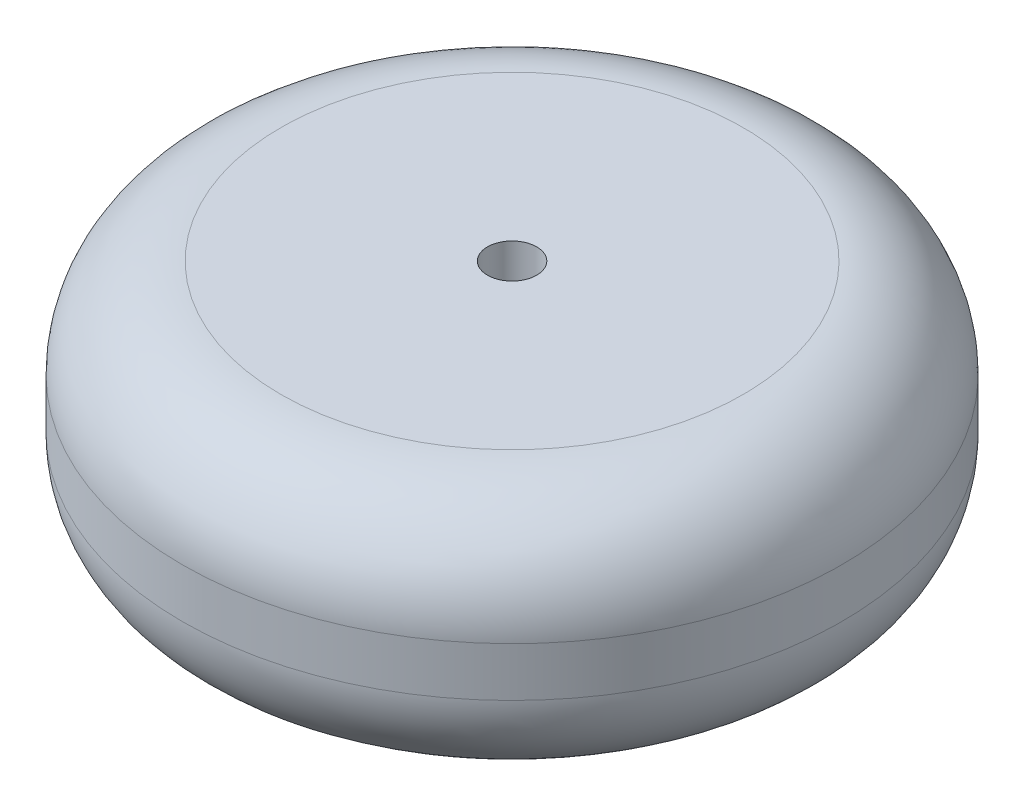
SolidWorks part; units mm, degrees
ref_plane "Front Plane" through (0, 0, 0) normal (0, 0, 1) x (1, 0, 0)
ref_plane "Top Plane" through (0, 0, 0) normal (0, 1, 0) x (1, 0, 0)
ref_plane "Right Plane" through (0, 0, 0) normal (1, 0, 0) x (0, 0, -1)
sketch "Sketch1" plane through (0, 0, 0) normal (0, 1, 0) x (1, 0, 0)
  circle A0 centre (0, 0) radius 33.5
  dimension "D1" = 67
extrude "Boss-Extrude1" add sketch "Sketch1" along normal blind 25
fillet "Fillet1" radius 10 2 edges at (0, 0, 33.5) (0, 25, 33.5)
sketch "Sketch2" plane through (0, 25, 0) normal (0, 1, 0) x (1, 0, 0)
  circle A0 centre (0, 0) radius 2.5
  dimension "D1" = 5
extrude "Cut-Extrude1" cut sketch "Sketch2" against normal blind 8
